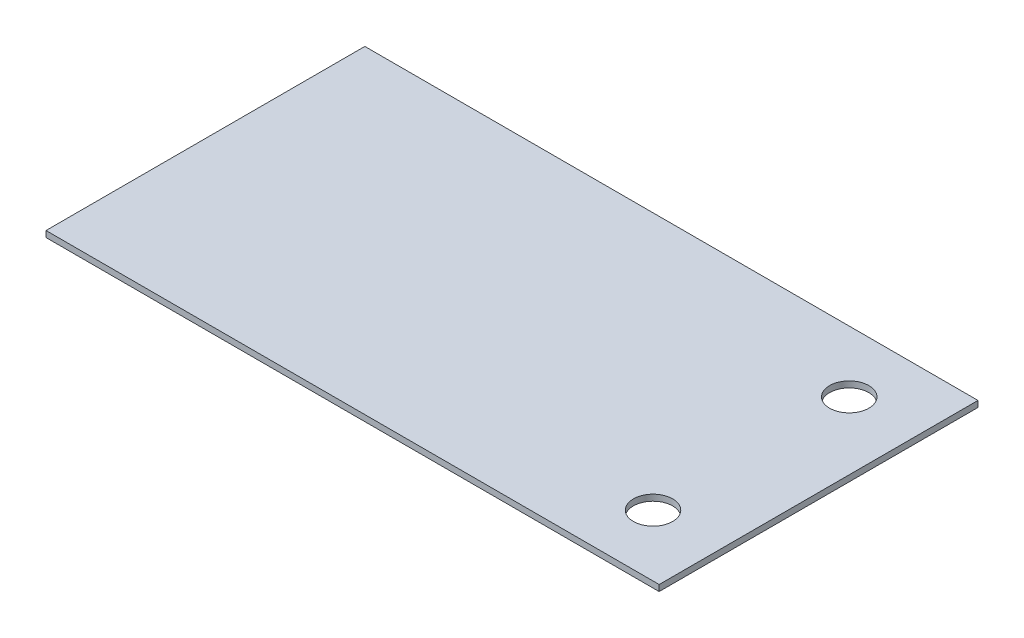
SolidWorks part; units mm, degrees
ref_plane "Face" through (0, 0, 0) normal (0, 0, 1) x (1, 0, 0)
ref_plane "Dessus" through (0, 0, 0) normal (0, 1, 0) x (1, 0, 0)
ref_plane "Droite" through (0, 0, 0) normal (1, 0, 0) x (0, 0, -1)
sketch "Esquisse1" plane through (0, 0, 0) normal (0, 1, 0) x (1, 0, 0)
  line L0 (44.5, 26) -> (44.5, 0) construction
  line L5 (0, 0) -> (50, 0)
  line L6 (0, 0) -> (0, 26)
  line L13 (0, 26) -> (50, 26)
  line L14 (50, 0) -> (50, 26)
  line L15 (50, 13) -> (0, 13) construction
  circle A3 centre (44.5, 21) radius 1.6
  circle A4 centre (44.5, 5) radius 1.6
  dimension "D1" = 50
  dimension "D2" = 26
  dimension "D4" = 16
  dimension "D3" = 5.5
extrude "Boss.-Extru.1" add sketch "Esquisse1" along normal blind 0.5
